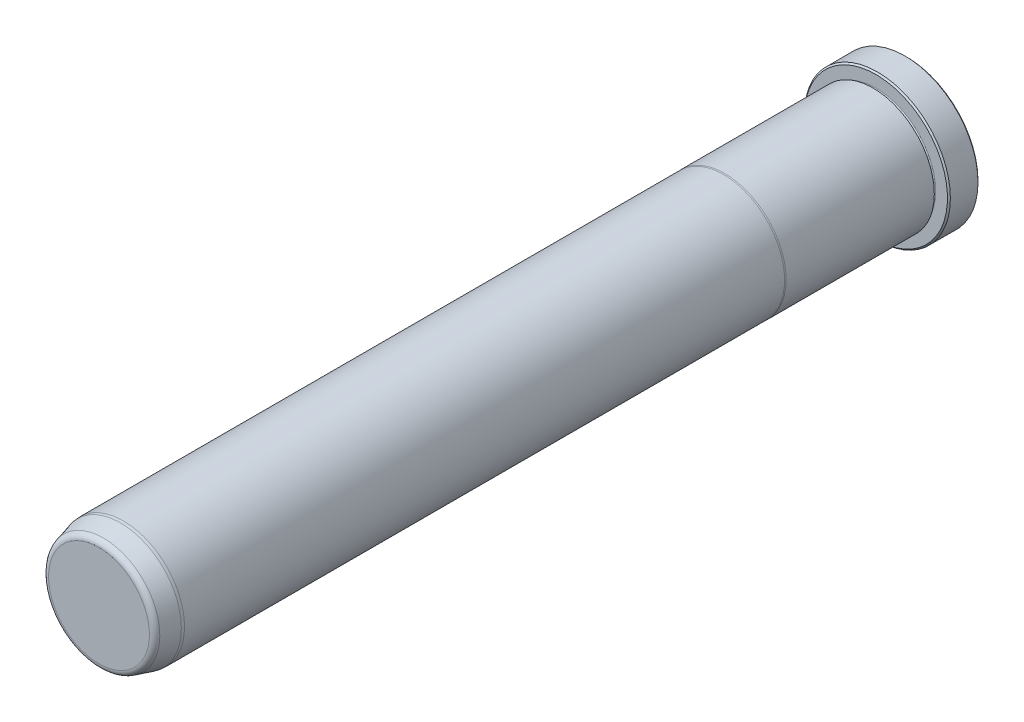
SolidWorks part; units mm, degrees
ref_plane "Front Plane" through (0, 0, 0) normal (0, 0, 1) x (1, 0, 0)
ref_plane "Top Plane" through (0, 0, 0) normal (0, 1, 0) x (1, 0, 0)
ref_plane "Right Plane" through (0, 0, 0) normal (1, 0, 0) x (0, 0, -1)
sketch "Sketch1" plane through (0, 0, 0) normal (1, 0, 0) x (0, 0, -1)
  line L0 (0, 0) -> (0, 18.923)
  line L1 (0, 18.923) -> (-7.9248, 18.923)
  line L2 (-7.9248, 18.923) -> (-7.9248, 15.4813)
  line L3 (-4.7498, 15.1003) -> (-5.5118, 15.1003) construction
  line L4 (-8.6868, 15.4813) -> (-8.6868, 15.8877)
  line L5 (-8.6868, 15.8877) -> (-47.1348, 15.8877)
  line L6 (-47.1348, 15.8877) -> (-47.498, 15.8623)
  line L7 (-47.498, 15.8623) -> (-203.2, 15.8623)
  line L9 (-209.55, 14.2983) -> (-209.55, 0)
  line L10 (-209.55, 0) -> (0, 0)
  line L11 (0, 0) -> (13.6287, 0) construction
  line L12 (-203.2, 15.8623) -> (-203.962, 15.7956)
  line L13 (-203.962, 15.7956) -> (-209.55, 14.2983)
  arc A0 (-8.6868, 15.4813) -> (-7.9248, 15.4813) centre (-8.3058, 15.4813) ccw
  dimension "D14" = 0.762
  dimension "D1" = 7.9248
  dimension "D2" = 0.762
  dimension "D3" = 37.846
  dimension "D4" = 31.7754
  dimension "D5" = 47.498
  dimension "D6" = 209.55
  dimension "D7" = 0.7874
  dimension "D8" = 4
  dimension "D9" = 31.7246
  dimension "D10" = 5
  dimension "D11" = 15
  dimension "D12" = 0.762
  dimension "D13" = 6.35
revolve "Revolve1" add sketch "Sketch1" angle 360 about L11
fillet "Fillet6" radius 1.5875 1 edges at (14.2983, 0, 209.55)
chamfer "Chamfer1" distance 0.381 angle 45 2 edges at (18.923, 0, 0) (18.923, 0, 7.9248)
